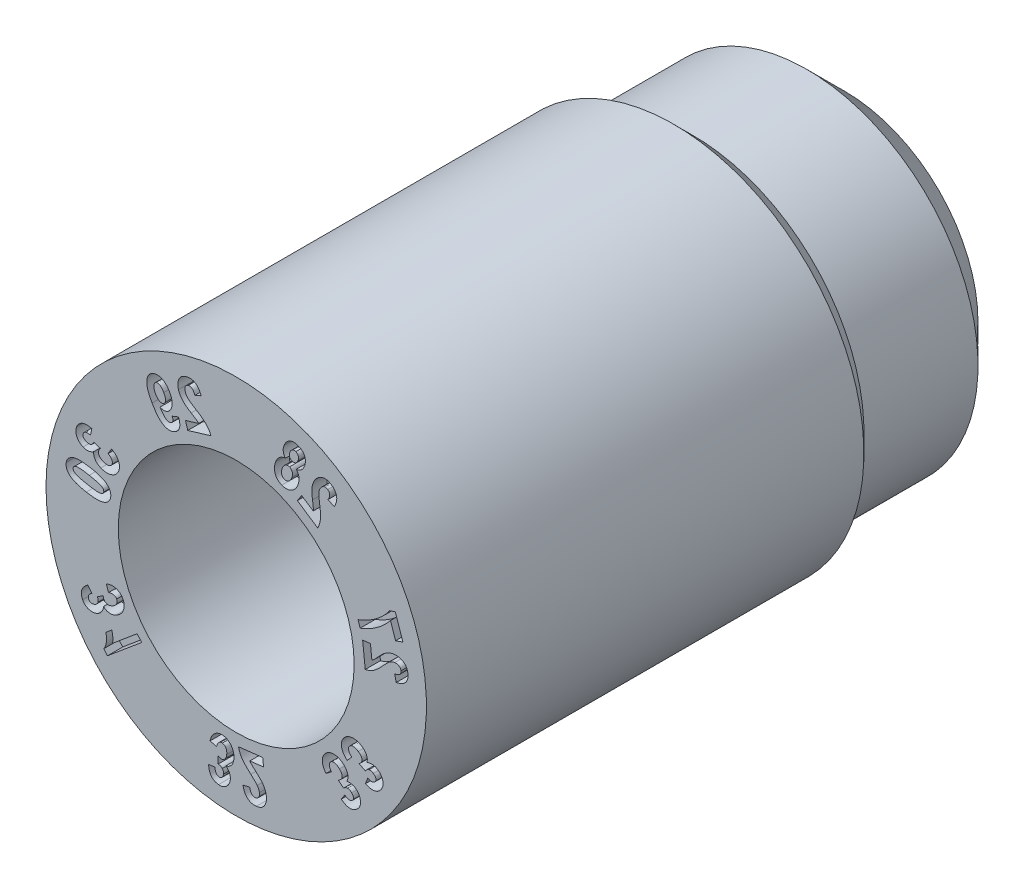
SolidWorks part; units mm, degrees
ref_plane "Front Plane" through (0, 0, 0) normal (0, 0, 1) x (1, 0, 0)
ref_plane "Top Plane" through (0, 0, 0) normal (0, 1, 0) x (1, 0, 0)
ref_plane "Right Plane" through (0, 0, 0) normal (1, 0, 0) x (0, 0, -1)
sketch "Sketch2" plane through (0, 0, 0) normal (0, 1, 0) x (1, 0, 0)
  line L0 (0, 4.8491) -> (0, -49995.1509) construction
  line L10 (1.7496, 8) -> (0.8, 8)
  line L11 (2.25, 7.4996) -> (1.7496, 8)
  line L12 (2.25, 6) -> (2.25, 7.4996)
  line L13 (2.5, 5.75) -> (2.25, 6)
  line L14 (2.5, 0) -> (2.5, 5.75)
  line L15 (1.55, 0) -> (2.5, 0)
  line L16 (1.55, 0) -> (1.55, 5.5)
  line L17 (0.8, 5.5) -> (1.55, 5.5)
  line L18 (0.8, 5.5) -> (0.8, 8)
  dimension "D1" = 5
  dimension "D2" = 3.1
  dimension "D3" = 2.5
  dimension "D4" = 1.6
  dimension "D5" = 4.5
  dimension "D6" = 8
  dimension "D7" = 45
  dimension "D8" = 45
  dimension "D9" = 2
  dimension "D10" = 0.5004
revolve "Revolve1" add sketch "Sketch2" angle 360 about L0
sketch "Sketch8" plane through (0, 0, 0) normal (0, 0, 1) x (1, 0, 0)
  line L0 (0, 0) -> (1.9546, 1.5587) construction
  line L1 (0, 0) -> (2.4373, -0.5563) construction
  line L2 (0, 0) -> (1.0847, -2.2524) construction
  line L3 (0, 0) -> (-1.0847, -2.2524) construction
  line L4 (0, 0) -> (-2.4373, -0.5563) construction
  line L5 (0, 0) -> (-1.9546, 1.5587) construction
  line L97 (0, 0) -> (0, 2.5) construction
  circle A30 centre (0, 0) radius 1.6979 construction
  circle A31 centre (0, 0) radius 2.5 construction
  text T0 "27    28    29    30    31     32    33" font "Arial Narrow" height 0.58
  point P9 (0, 0)
  dimension "D1" = 7
extrude "Cut-Extrude1" cut sketch "Sketch8" against normal blind 0.2
